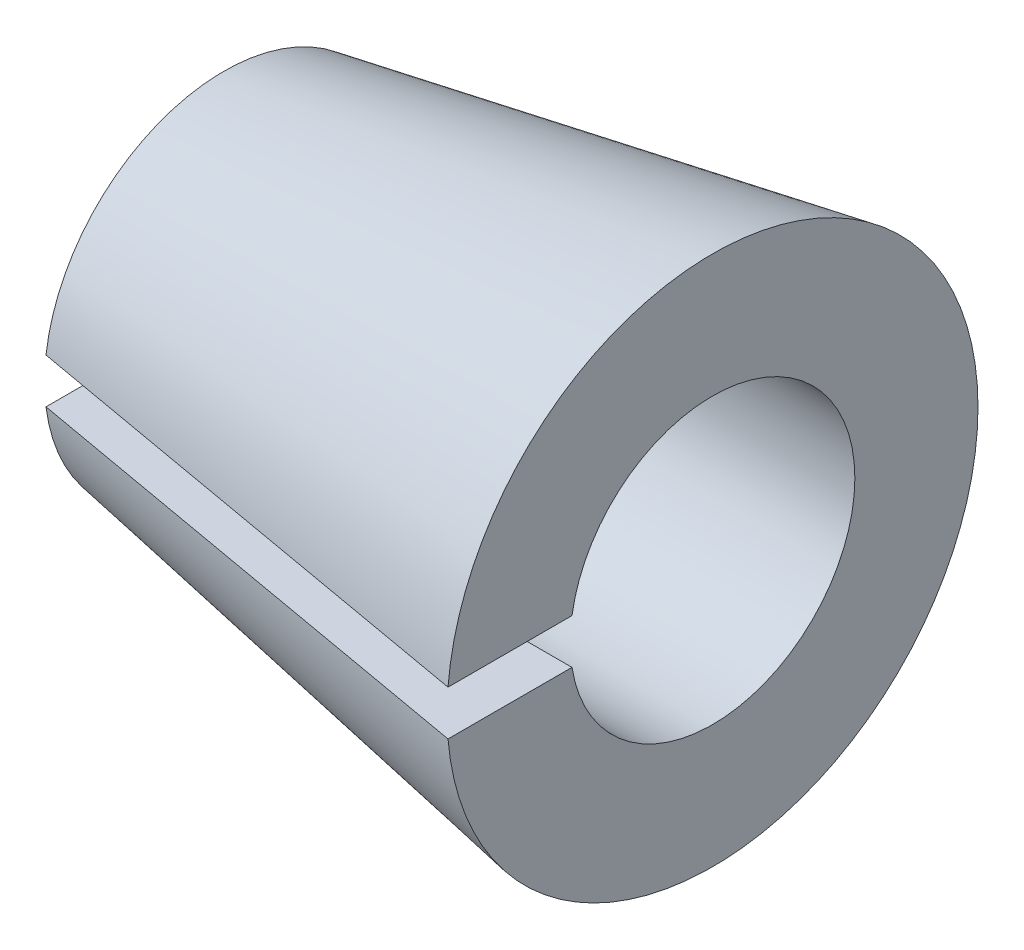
SolidWorks part; units mm, degrees
ref_plane "Front Plane" through (0, 0, 0) normal (0, 0, 1) x (1, 0, 0)
ref_plane "Top Plane" through (0, 0, 0) normal (0, 1, 0) x (1, 0, 0)
ref_plane "Right Plane" through (0, 0, 0) normal (1, 0, 0) x (0, 0, -1)
sketch "Sketch1" plane through (0, 0, 0) normal (0, 0, 1) x (1, 0, 0)
  line L0 (0, 0) -> (10.9, 0) construction
  line L1 (10.9, 3.175) -> (10.9, 5.922)
  line L2 (10.9, 5.922) -> (0, 4)
  line L3 (0, 4) -> (0, 3.175)
  line L4 (0, 3.175) -> (10.9, 3.175)
  dimension "D1" = 10.9
  dimension "D2" = 3.175
  dimension "D3" = 4
  dimension "D4" = 10
revolve "Revolve1" add sketch "Sketch1" angle 360 about L0
sketch "Sketch2" plane through (10.9, 0, 0) normal (1, 0, 0) x (0, 0, -1)
  line L0 (0, 0) -> (-6.8829, 0) construction
  line L1 (0, 0.5) -> (-6.8829, 0.5)
  line L2 (0, -0.5) -> (-6.8829, -0.5)
  line L3 (-6.8829, 0.5) -> (-6.8829, -0.5)
  line L4 (0, 0.5) -> (0, -0.5)
  dimension "D1" = 0.5
  dimension "D2" = 0.5
extrude "Cut-Extrude1" cut sketch "Sketch2" against normal through all
